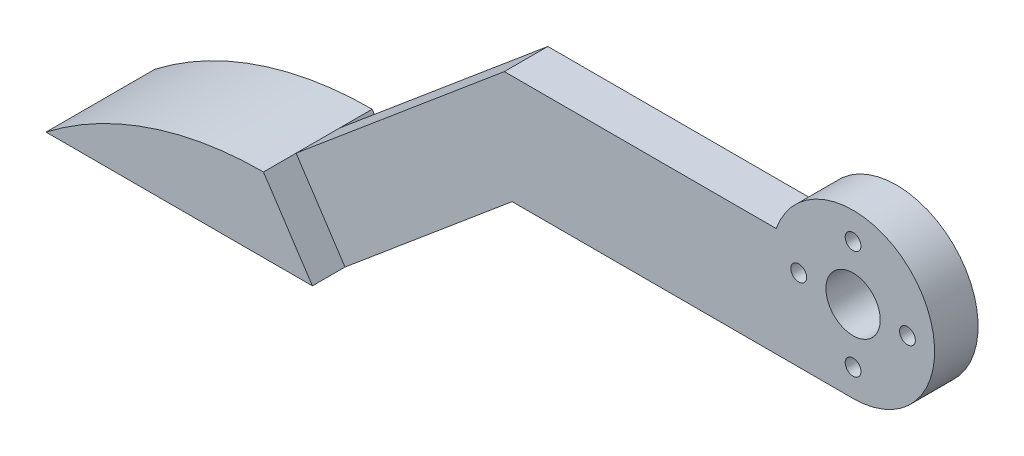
SolidWorks part; units mm, degrees
ref_plane "Front Plane" through (0, 0, 0) normal (0, 0, 1) x (1, 0, 0)
ref_plane "Top Plane" through (0, 0, 0) normal (0, 1, 0) x (1, 0, 0)
ref_plane "Right Plane" through (0, 0, 0) normal (1, 0, 0) x (0, 0, -1)
sketch "Sketch1" plane through (0, 0, 0) normal (0, 0, 1) x (1, 0, 0)
  line L0 (-14.1421, 5) -> (-64.1421, 5)
  line L1 (0, -15) -> (-62.7098, -15)
  line L2 (-64.1421, 5) -> (-102.4444, -27.1394)
  line L7 (-93.4444, -40.7894) -> (-62.7098, -15)
  line L12 (-102.4444, -27.1394) -> (-93.4444, -40.7894)
  arc A0 (0, -15) -> (-14.1421, 5) centre (0, 0) ccw
  circle A1 centre (0, 0) radius 5
  dimension "D1" = 10
  dimension "D2" = 30
  dimension "D3" = 140
extrude "Boss-Extrude1" add sketch "Sketch1" along normal blind 8
sketch "Sketch2" plane through (0, 0, 8) normal (0, 0, 1) x (1, 0, 0)
  line L0 (-10, 0) -> (10, 0) construction
  line L1 (0, 10) -> (0, -10) construction
sketch "Sketch3" plane through (0, 0, 0) normal (0, 0, -1) x (-1, 0, 0)
  circle A0 centre (-10, 0) radius 1.45
  circle A1 centre (10, 0) radius 1.45
  circle A2 centre (0, -10) radius 1.45
  circle A3 centre (0, 10) radius 1.45
  dimension "D1" = 2.9
extrude "Cut-Extrude1" cut sketch "Sketch3" against normal through all
ref_plane "Plane1" through (0, 0, 4) normal (0, 0, 1) x (1, 0, 0)
sketch "Sketch6" plane through (0, 0, 4) normal (0, 0, 1) x (1, 0, 0)
  line L0 (-142.4444, -40.7894) -> (-93.4444, -40.7894)
  line L1 (-93.4444, -40.7894) -> (-102.4444, -27.1394)
  line L3 (-97.9444, -33.9644) -> (-94.4434, -31.656) construction
  line L4 (-102.4444, -27.1394) -> (-93.4444, -40.7894) construction
  arc A0 (-102.4444, -27.1394) -> (-142.4444, -40.7894) centre (-102.4444, -92.5724) ccw
extrude "Boss-Extrude2" add sketch "Sketch6" along normal mid plane 20 contours A0 L0 L1
